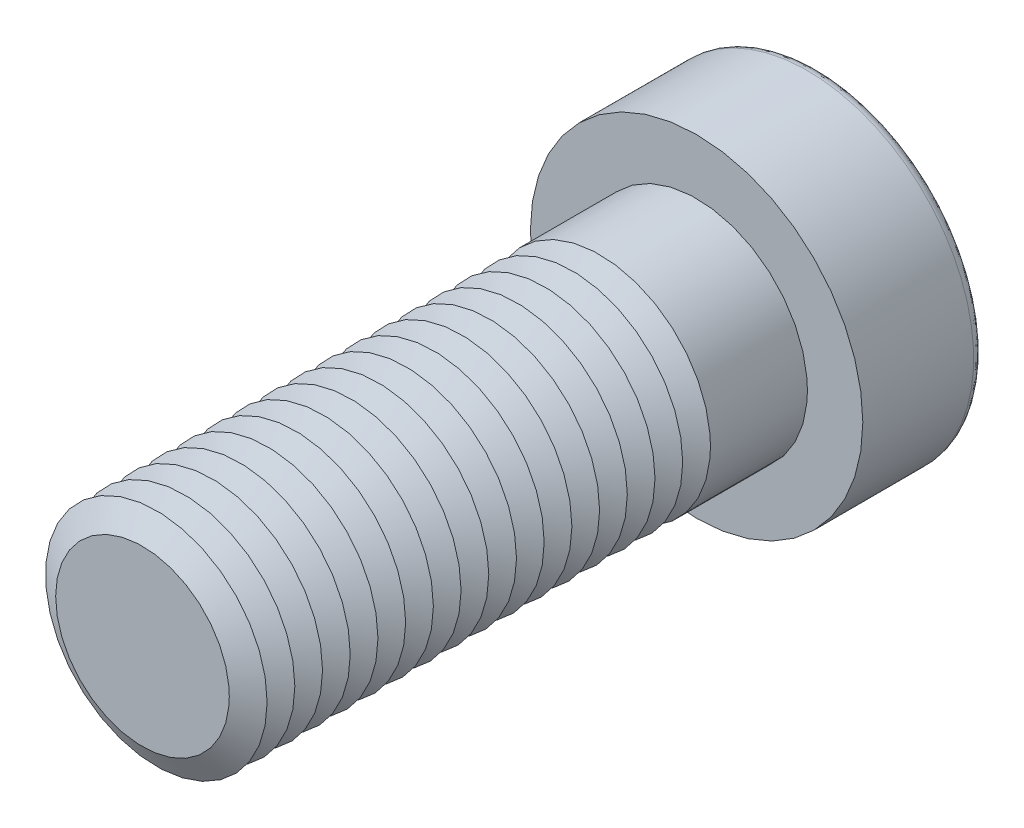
SolidWorks part; units mm, degrees
ref_plane "Front Plane" through (0, 0, 0) normal (0, 0, 1) x (1, 0, 0)
ref_plane "Top Plane" through (0, 0, 0) normal (0, 1, 0) x (1, 0, 0)
ref_plane "Right Plane" through (0, 0, 0) normal (1, 0, 0) x (0, 0, -1)
sketch "Sketch1" plane through (0, 0, 0) normal (0, 0, 1) x (1, 0, 0)
  circle A0 centre (0, 0) radius 10
  dimension "D1" = 20
extrude "Boss-Extrude1" add sketch "Sketch1" along normal blind 50
sketch "Sketch2" plane through (0, 0, 0) normal (0, 0, -1) x (-1, 0, 0)
  circle A0 centre (0, 0) radius 15
  dimension "D1" = 30
extrude "Boss-Extrude2" add sketch "Sketch2" along normal blind 11
sketch "Sketch3" plane through (0, 0, -11) normal (0, 0, -1) x (-1, 0, 0)
  line L1 (-4.0415, 7) -> (-8.0829, 0)
  line L2 (-8.0829, 0) -> (-4.0415, -7)
  line L3 (-4.0415, -7) -> (4.0415, -7)
  line L4 (4.0415, -7) -> (8.0829, 0)
  line L5 (8.0829, 0) -> (4.0415, 7)
  line L6 (4.0415, 7) -> (-4.0415, 7)
  circle A0 centre (0, 0) radius 7 construction
  dimension "D1" = 14
extrude "Cut-Extrude1" cut sketch "Sketch3" against normal blind 10.5
fillet "Fillet1" radius 1 1 edges at (-15, 0, -11)
sketch "Sketch4" plane through (0, 0, -0.5) normal (0, 0, -1) x (-1, 0, 0)
  line L0 (4.0415, -7) -> (8.0829, 0) construction
  circle A0 centre (0, 0) radius 7
extrude "Cut-Extrude2" cut sketch "Sketch4" against normal through all draft 60
sketch "Sketch5" plane through (0, 0, -11) normal (0, 0, -1) x (-1, 0, 0)
  circle A0 centre (0, 0) radius 8.0829
extrude "Cut-Extrude3" cut sketch "Sketch5" against normal through all draft 75
sketch "Sketch7" plane through (0, 0, 0) normal (1, 0, 0) x (0, 0, -1)
  line L25 (-50, 7.8349) -> (-48.75, 10)
  line L26 (-50, 10) -> (-50, -10) construction
  line L27 (-48.75, 10) -> (-51.25, 10)
  line L28 (-51.25, 10) -> (-50, 7.8349)
  line L29 (0, 10) -> (-50, 10) construction
  dimension "D1" = 2.5
revolve "Cut-Revolve1" cut sketch "Sketch7" angle 360 about axis through (0, 0, 50) along (0, 0, -1)
pattern_linear "LPattern1" count 17 spacing 2.5 along (0, 0, -1) of "Cut-Revolve1"
